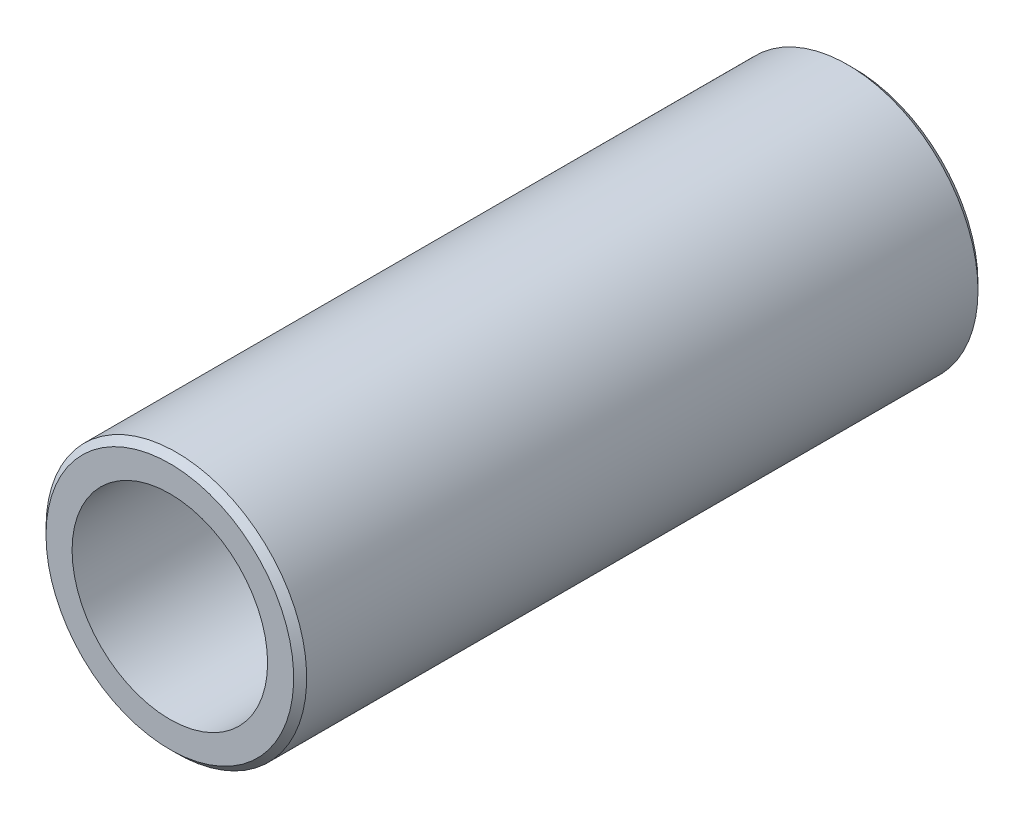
SolidWorks part; units mm, degrees
ref_plane "Plan de face" through (0, 0, 0) normal (0, 0, 1) x (1, 0, 0)
ref_plane "Plan de dessus" through (0, 0, 0) normal (0, 1, 0) x (1, 0, 0)
ref_plane "Plan de droite" through (0, 0, 0) normal (1, 0, 0) x (0, 0, -1)
sketch "Esquisse1" plane through (0, 0, 0) normal (0, 0, 1) x (1, 0, 0)
  circle A0 centre (0, 0) radius 20
  dimension "D1" = 40
extrude "Extru.-Mince1" add sketch "Esquisse1" along normal blind 105 thin
chamfer "Chanfrein1" distance 1 angle 45 2 edges at (20, 0, 0) (20, 0, 105)
